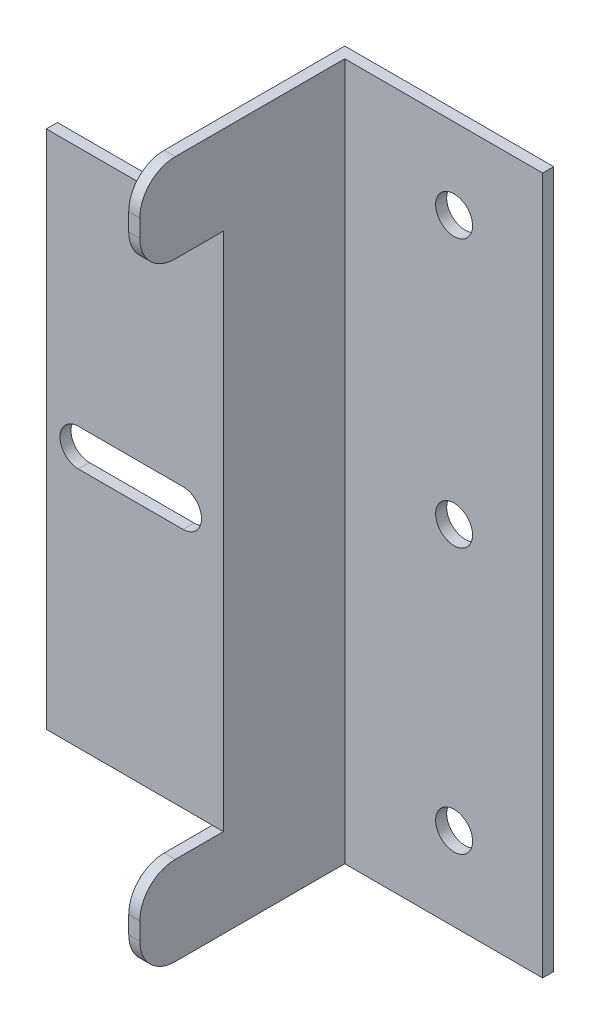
SolidWorks part; units mm, degrees
ref_plane "Front Plane" through (0, 0, 0) normal (1, 0, 0) x (0, 1, 0)
ref_plane "Top Plane" through (0, 0, 0) normal (0, 0, 1) x (0, 1, 0)
ref_plane "Right Plane" through (0, 0, 0) normal (0, 1, 0) x (-1, 0, 0)
sketch "Sketch1" plane through (0, 0, 0) normal (0, 1, 0) x (-1, 0, 0)
  line L0 (-29.972, 0) -> (0, 0)
  line L1 (0, 0) -> (0, 17.4117)
  line L2 (0, 17.4117) -> (23.8125, 17.4117)
  line L3 (-29.972, 1.5875) -> (-1.5875, 1.5875)
  line L4 (-1.5875, 1.5875) -> (-1.5875, 18.9992)
  line L5 (-1.5875, 18.9992) -> (23.8125, 18.9992)
  line L6 (-29.972, 1.5875) -> (-29.972, 0)
  line L7 (23.8125, 18.9992) -> (23.8125, 17.4117)
  point P9 (23.8125, 18.2055)
  dimension "D2" = 29.972
  dimension "D3" = 18.9992
  dimension "D4" = 25.4
  dimension "D1" = 1.5875
extrude "Boss-Extrude1" add sketch "Sketch1" along normal mid plane 99.9998
sketch "Sketch2" plane through (1.5875, 0, 0) normal (1, 0, 0) x (0, 1, 0)
  line L0 (-49.9999, 18.9992) -> (-49.9999, 25.908)
  line L1 (-44.9199, 30.988) -> (-42.3799, 30.988)
  line L2 (-37.2999, 25.908) -> (-37.2999, 18.9992)
  line L3 (49.9999, 18.9992) -> (-49.9999, 18.9992) construction
  line L4 (-49.9999, 18.9992) -> (-37.2999, 18.9992)
  line L5 (0, -10.4496) -> (0, 10.4496) construction
  line L6 (49.9999, 18.9992) -> (37.2999, 18.9992)
  line L7 (37.2999, 25.908) -> (37.2999, 18.9992)
  line L8 (44.9199, 30.988) -> (42.3799, 30.988)
  line L9 (49.9999, 18.9992) -> (49.9999, 25.908)
  arc A0 (-42.3799, 30.988) -> (-37.2999, 25.908) centre (-42.3799, 25.908) cw
  arc A1 (-49.9999, 25.908) -> (-44.9199, 30.988) centre (-44.9199, 25.908) cw
  arc A2 (49.9999, 25.908) -> (44.9199, 30.988) centre (44.9199, 25.908) ccw
  arc A3 (42.3799, 30.988) -> (37.2999, 25.908) centre (42.3799, 25.908) ccw
  point P11 (-49.9999, 30.988)
  point P22 (49.9999, 30.988)
  dimension "D3" = 5.08
  dimension "D1" = 12.7
  dimension "D2" = 11.9888
extrude "Boss-Extrude2" add sketch "Sketch2" against normal blind 1.5875
sketch "Sketch3" plane through (-23.8125, 0, 0) normal (-1, 0, 0) x (0, -1, 0)
  line L1 (-49.9999, 17.4117) -> (-37.2999, 17.4117)
  line L2 (-49.9999, 17.4117) -> (-49.9999, 18.9992)
  line L3 (-49.9999, 18.9992) -> (-37.2999, 18.9992)
  line L4 (-37.2999, 17.4117) -> (-37.2999, 18.9992)
  line L5 (49.9999, 17.4117) -> (37.2999, 17.4117)
  line L6 (49.9999, 17.4117) -> (49.9999, 18.9992)
  line L7 (49.9999, 18.9992) -> (37.2999, 18.9992)
  line L8 (37.2999, 17.4117) -> (37.2999, 18.9992)
extrude "Cut-Extrude1" cut sketch "Sketch3" against normal up to surface (23.8125 mm away)
sketch "Sketch4" plane through (0, 0, 18.9992) normal (0, 0, 1) x (1, 0, 0)
  line L0 (-19.2019, 0) -> (-4.1977, 0) construction
  line L1 (-19.2019, 2.65) -> (-4.1977, 2.65)
  line L2 (-19.2019, -2.65) -> (-4.1977, -2.65)
  line L3 (29.972, 49.9999) -> (29.972, -49.9999) construction
  arc A0 (-19.2019, 2.65) -> (-19.2019, -2.65) centre (-19.2019, 0) ccw
  arc A1 (-4.1977, -2.65) -> (-4.1977, 2.65) centre (-4.1977, 0) ccw
  circle A2 centre (17.272, -38.0495) radius 2.65
  circle A3 centre (17.272, 38.4089) radius 2.65
  circle A4 centre (17.272, 0) radius 2.65
  point P3 (-11.6998, 0)
  point P16 (16.9777, 0)
  point P17 (0, 0)
  dimension "D2" = 5.3
  dimension "D1" = 12.7
extrude "Cut-Extrude2" cut sketch "Sketch4" against normal through all both and the other way through all
